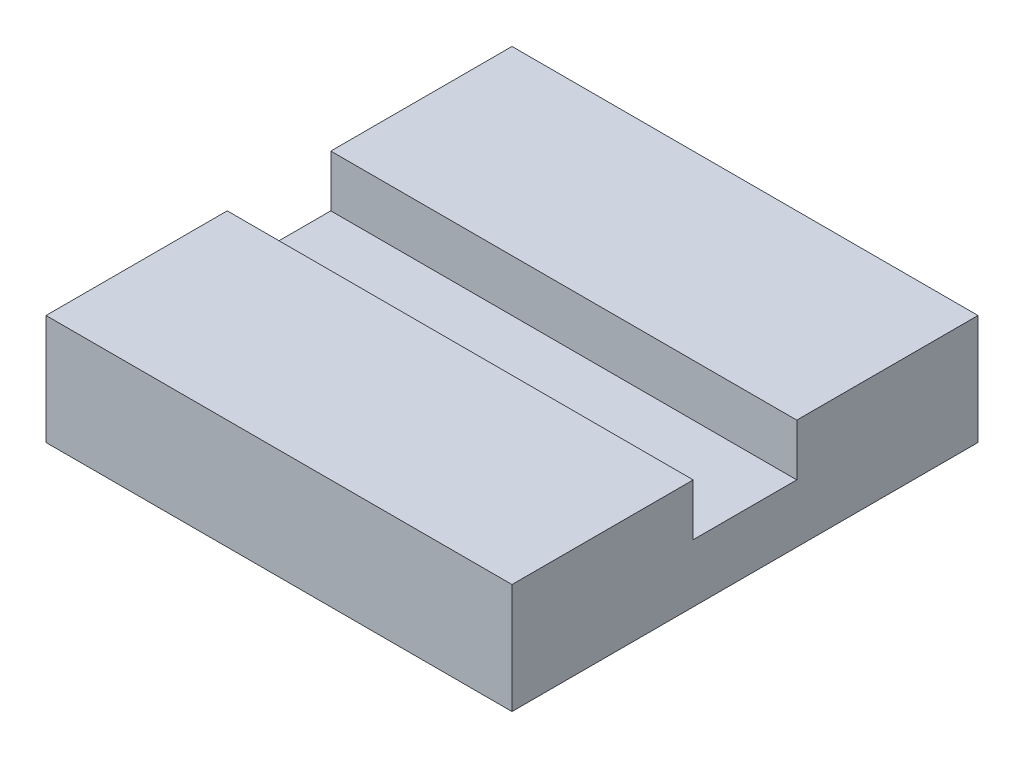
SolidWorks part; units mm, degrees
ref_plane "Front Plane" through (0, 0, 0) normal (0, 0, 1) x (1, 0, 0)
ref_plane "Top Plane" through (0, 0, 0) normal (0, 1, 0) x (1, 0, 0)
ref_plane "Right Plane" through (0, 0, 0) normal (1, 0, 0) x (0, 0, -1)
sketch "Sketch1" plane through (0, 0, 0) normal (0, 1, 0) x (1, 0, 0)
  line L1 (45, -45) -> (-45, -45)
  line L2 (45, -45) -> (45, 45)
  line L3 (45, 45) -> (-45, 45)
  line L4 (-45, -45) -> (-45, 45)
  line L5 (45, -45) -> (-45, 45) construction
  line L6 (45, 45) -> (-45, -45) construction
  point P0 (0, 0)
  dimension "D1" = 90
  dimension "D2" = 90
extrude "Boss-Extrude1" add sketch "Sketch1" along normal blind 21.25
sketch "Sketch3" plane through (0, 0, 0) normal (0, -1, 0) x (1, 0, 0)
  circle A0 centre (0, 0) radius 10
  dimension "D1" = 20
extrude "Boss-Extrude2" add sketch "Sketch3" along normal blind 20
sketch "Sketch4" plane through (45, 0, 0) normal (1, 0, 0) x (0, 0, -1)
  line L0 (-45, 21.25) -> (45, 21.25) construction
  line L1 (-10, 21.25) -> (10, 21.25)
  line L2 (-10, 21.25) -> (-10, 11.25)
  line L3 (-10, 11.25) -> (10, 11.25)
  line L4 (10, 21.25) -> (10, 11.25)
  point P6 (0, 11.25)
  dimension "D1" = 10
  dimension "D2" = 20
extrude "Cut-Extrude2" cut sketch "Sketch4" against normal through all
